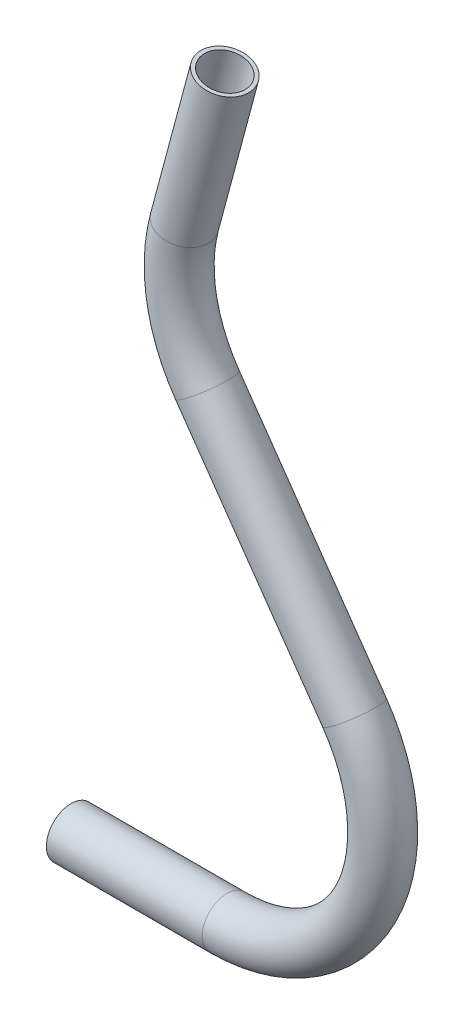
SolidWorks part; units mm, degrees
ref_plane "Plan de face" through (0, 0, 0) normal (0, 0, 1) x (1, 0, 0)
ref_plane "Plan de dessus" through (0, 0, 0) normal (0, 1, 0) x (1, 0, 0)
ref_plane "Plan de droite" through (0, 0, 0) normal (1, 0, 0) x (0, 0, -1)
sketch "Esquisse1" plane through (0, 0, 0) normal (0, 0, 1) x (1, 0, 0)
  line L0 (0, 0) -> (85, 0)
  line L1 (85, 85) -> (138.6351, 85) construction
  line L2 (85, 85) -> (160.7716, 138.0558) construction
  line L3 (154.6279, 133.754) -> (74.3272, 248.4353)
  line L4 (143.9551, 297.1893) -> (37.3301, 297.1893) construction
  line L5 (37.3301, 297.1893) -> (143.9551, 297.1893) construction
  line L6 (143.9551, 297.1893) -> (61.8515, 319.1889) construction
  line L7 (61.8515, 319.1889) -> (83.8511, 401.2926)
  arc A0 (85, 0) -> (154.6279, 133.754) centre (85, 85) ccw
  arc A1 (74.3272, 248.4353) -> (61.8515, 319.1889) centre (143.9551, 297.1893) cw
  dimension "D2" = 85
  dimension "D6" = 85
  dimension "D1" = 85
  dimension "D3" = 35
  dimension "D4" = 140
  dimension "D5" = 15
  dimension "D7" = 85
sketch "Esquisse2" plane through (0, 0, 0) normal (1, 0, 0) x (0, 0, -1)
  circle A0 centre (0, 0) radius 13.5
  circle A1 centre (0, 0) radius 11.5
  dimension "D1" = 27
  dimension "D2" = 23
sweep "Balayage1" add profiles "Esquisse2" path "Esquisse1"
